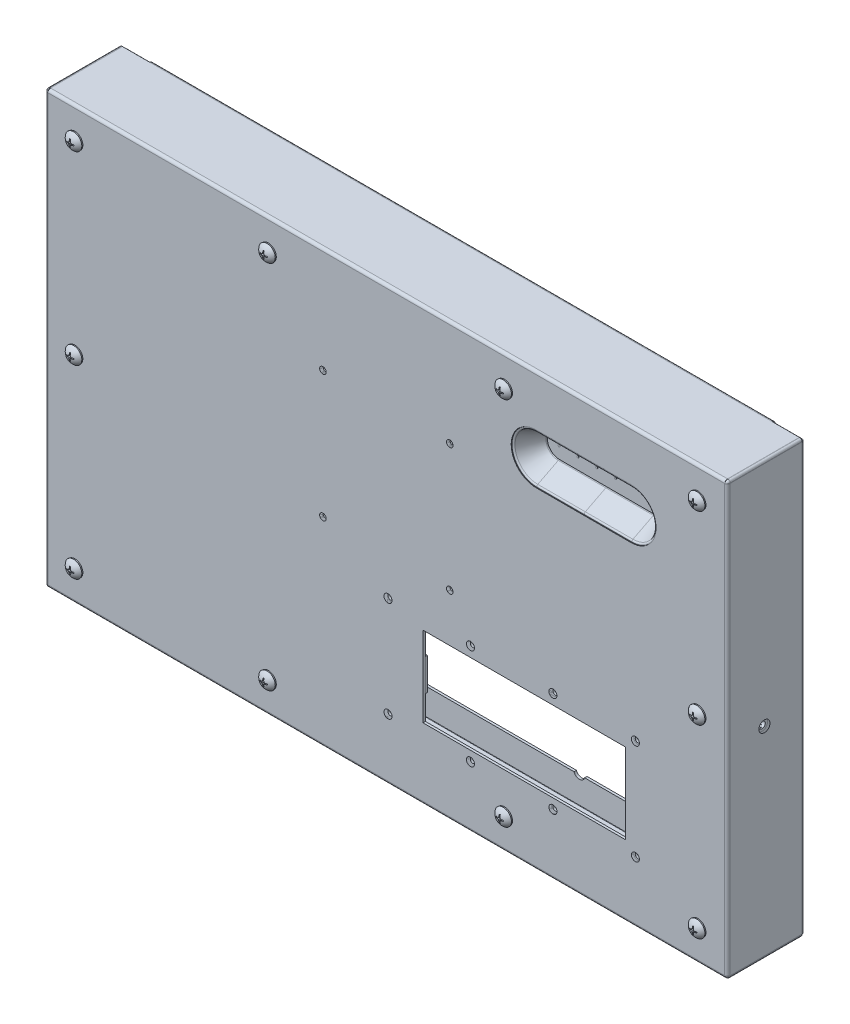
SolidWorks part; units mm, degrees
ref_plane "Front Plane" through (0, 0, 0) normal (0, 0, 1) x (1, 0, 0)
ref_plane "Top Plane" through (0, 0, 0) normal (0, 1, 0) x (1, 0, 0)
ref_plane "Right Plane" through (0, 0, 0) normal (1, 0, 0) x (0, 0, -1)
imported_body "Surface-Imported1"
imported_body "Surface-Imported2"
imported_body "Surface-Imported3"
imported_body "Surface-Imported4"
imported_body "Surface-Imported5"
imported_body "Surface-Imported6"
imported_body "Surface-Imported7"
imported_body "Surface-Imported8"
imported_body "Surface-Imported9"
imported_body "Surface-Imported10"
imported_body "Surface-Imported11"
imported_body "Surface-Imported12"
imported_body "Surface-Imported13"
imported_body "Surface-Imported14"
imported_body "Surface-Imported15"
imported_body "Surface-Imported16"
imported_body "Surface-Imported17"
imported_body "Surface-Imported18"
imported_body "Surface-Imported19"
imported_body "Surface-Imported20"
imported_body "Surface-Imported21"
imported_body "Surface-Imported22"
imported_body "Surface-Imported23"
imported_body "Surface-Imported24"
imported_body "Surface-Imported25"
imported_body "Surface-Imported26"
imported_body "Surface-Imported27"
imported_body "Surface-Imported28"
imported_body "Surface-Imported29"
imported_body "Surface-Imported30"
imported_body "Surface-Imported31"
imported_body "Surface-Imported32"
imported_body "Surface-Imported33"
imported_body "Surface-Imported34"
imported_body "Surface-Imported35"
imported_body "Surface-Imported36"
imported_body "Surface-Imported37"
imported_body "Surface-Imported38"
imported_body "Surface-Imported39"
imported_body "Surface-Imported40"
imported_body "Surface-Imported41"
imported_body "Surface-Imported42"
imported_body "Surface-Imported43"
imported_body "Surface-Imported44"
imported_body "Surface-Imported45"
imported_body "Surface-Imported46"
imported_body "Surface-Imported47"
imported_body "Surface-Imported48"
imported_body "Surface-Imported49"
imported_body "Surface-Imported50"
imported_body "Surface-Imported51"
imported_body "Surface-Imported52"
imported_body "Surface-Imported53"
imported_body "Surface-Imported54"
imported_body "Surface-Imported55"
imported_body "Surface-Imported56"
imported_body "Surface-Imported57"
imported_body "Surface-Imported58"
imported_body "Surface-Imported59"
imported_body "Surface-Imported60"
imported_body "Surface-Imported61"
imported_body "Surface-Imported62"
imported_body "Surface-Imported63"
imported_body "Surface-Imported64"
imported_body "Surface-Imported65"
imported_body "Surface-Imported66"
imported_body "Surface-Imported67"
imported_body "Surface-Imported68"
sketch "Sketch2" plane through (266.9286, 0, 0) normal (-1, 0, 0) x (0, 0, 1)
  circle A0 centre (36.2966, -11.3208) radius 5.3152
extrude "Boss-Extrude2" add sketch "Sketch2" along normal blind 15
sketch "Sketch3" plane through (-266.9286, 0, 0) normal (1, 0, 0) x (0, 0, -1)
  circle A0 centre (-36.2966, -11.3208) radius 4.3688
extrude "Boss-Extrude3" add sketch "Sketch3" along normal blind 15 separate body
sketch "Sketch4" plane through (0, 0, 63.6016) normal (0, 0, -1) x (-1, 0, 0)
  line L1 (-65.5753, 107.4103) -> (81.7564, 107.4103)
  line L2 (-65.5753, 107.4103) -> (-65.5753, -25.8066)
  line L3 (10.5798, -25.8066) -> (81.7564, -25.8066)
  line L4 (81.7564, 107.4103) -> (81.7564, -25.8066)
  line L5 (-214.8477, -25.8066) -> (-65.5753, -25.8066)
  line L6 (-214.8477, -25.8066) -> (-214.8477, -133.9887)
  line L7 (-214.8477, -133.9887) -> (10.5798, -133.9887)
  line L8 (10.5798, -25.8066) -> (10.5798, -133.9887)
  line L9 (-191.7271, -48.1136) -> (-14.329, -48.1136)
  line L10 (-191.7271, -48.1136) -> (-191.7271, -116.6935)
  line L11 (-191.7271, -116.6935) -> (-14.329, -116.6935)
  line L12 (-14.329, -48.1136) -> (-14.329, -116.6935)
  point P12 (-65.5753, -25.8066)
  point P13 (81.7564, 107.4103)
extrude "Boss-Extrude4" add sketch "Sketch4" along normal blind 1.6 separate body
sketch "Sketch5" plane through (0, -168.1734, 0) normal (0, 1, 0) x (1, 0, 0)
  circle A0 centre (-177.8, -53.3108) radius 4.3688
  circle A1 centre (-177.8, -16.7348) radius 6.5503
  circle A2 centre (177.8, -16.7348) radius 6.0997
  circle A3 centre (177.8, -53.3108) radius 4.3688
extrude "Boss-Extrude5" add sketch "Sketch5" along normal blind 3 separate body
hole_wizard "M4x0.7 100mm VESA Mounting" positions "Sketch6" profile "Sketch7" tap size "M4x0.7" standard "ANSI Metric"
sketch "Sketch6" plane through (0, 0, 65.499) normal (0, 0, 1) x (1, 0, 0)
  point P0 (-50, 86.802)
  point P2 (-50, -13.198)
  point P4 (50, -13.198)
  point P6 (50, 86.802)
sketch "Sketch7" plane through (-50, 86.802, 65.499) normal (1, 0, 0) x (0, -1, 0)
  line L0 (0, 0) -> (0, 16.9914)
  line L1 (0, 16.9914) -> (1.65, 16)
  line L2 (1.65, 16) -> (1.65, 0)
  line L5 (1.65, 0) -> (0, 0)
  line L10 (0, 16.9914) -> (-1.65, 16) construction
  line L11 (0, -6.35) -> (0, 107.95) construction
  dimension "Tap Drill Dia." = 3.3
  dimension "Tap Drill Depth" = 16
  dimension "Drill Angle" = 118
hole_wizard "1/4-20 Yoke Mounting" positions "3DSketch4" profile "Sketch13" tap size "1/4-20" standard "ANSI Inch"
sketch3d "3DSketch4"
  line L0 (251.9286, -11.3208, 36.2966) -> (266.9286, -11.3208, 36.2966) construction
  line L1 (-251.9286, -11.3208, 36.2966) -> (-266.9286, -11.3208, 36.2966) construction
  point P0 (266.9286, -11.3208, 36.2966)
  point P4 (-266.9286, -11.3208, 36.2966)
sketch "Sketch13" plane through (266.9286, -11.3208, 36.2966) normal (0, 1, 0) x (0, 0, -1)
  line L0 (0, 0) -> (0, 20.3438)
  line L1 (0, 20.3438) -> (2.5527, 18.81)
  line L2 (2.5527, 18.81) -> (2.5527, 0)
  line L5 (2.5527, 0) -> (0, 0)
  line L10 (0, 20.3438) -> (-2.5527, 18.81) construction
  line L11 (0, -6.35) -> (0, 107.95) construction
  dimension "Tap Drill Dia." = 5.1054
  dimension "Tap Drill Depth" = 18.81
  dimension "Drill Angle" = 118
hole_wizard "1/4-20 Keyboard Mounting" positions "Sketch9" profile "Sketch10" tap size "1/4-20" standard "ANSI Inch"
sketch "Sketch9" plane through (0, -170.0708, 0) normal (0, -1, 0) x (-1, 0, 0)
  point P0 (177.8, -53.3108)
  point P2 (177.8, -16.7348)
  point P4 (-177.8, -53.3108)
  point P7 (-177.8, -16.7348)
sketch "Sketch10" plane through (-177.8, -170.0708, 53.3108) normal (1, 0, 0) x (0, 0, -1)
  line L0 (0, 0) -> (0, 21.2238)
  line L1 (0, 21.2238) -> (2.5527, 19.69)
  line L2 (2.5527, 19.69) -> (2.5527, 0)
  line L5 (2.5527, 0) -> (0, 0)
  line L10 (0, 21.2238) -> (-2.5527, 19.69) construction
  line L11 (0, -6.35) -> (0, 107.95) construction
  dimension "Tap Drill Dia." = 5.1054
  dimension "Tap Drill Depth" = 19.69
  dimension "Drill Angle" = 118
hole_wizard "#10-32 Connector Mounting" positions "Sketch14" profile "Sketch15" tap size "#10-32" standard "ANSI Inch"
sketch "Sketch14" plane through (0, 0, 65.499) normal (0, 0, 1) x (1, 0, 0)
  point P0 (1.3057, -43.1192)
  point P2 (66.3043, -43.1192)
  point P4 (131.3029, -43.1192)
  point P6 (196.2888, -43.1192)
  point P8 (196.2888, -122.2272)
  point P10 (1.3057, -122.2272)
  point P12 (66.3043, -122.2272)
  point P14 (131.3029, -122.2272)
sketch "Sketch15" plane through (1.3057, -43.1192, 65.499) normal (1, 0, 0) x (0, -1, 0)
  line L0 (0, 0) -> (0, 55.3145)
  line L1 (0, 55.3145) -> (2.0193, 55.3145)
  line L2 (2.0193, 55.3145) -> (2.0193, 0)
  line L5 (2.0193, 0) -> (0, 0)
  line L11 (0, -6.35) -> (0, 107.95) construction
  dimension "Thru Tap Drill Dia." = 4.0386
  dimension "Thru Tap Drill Depth" = 55.3145
